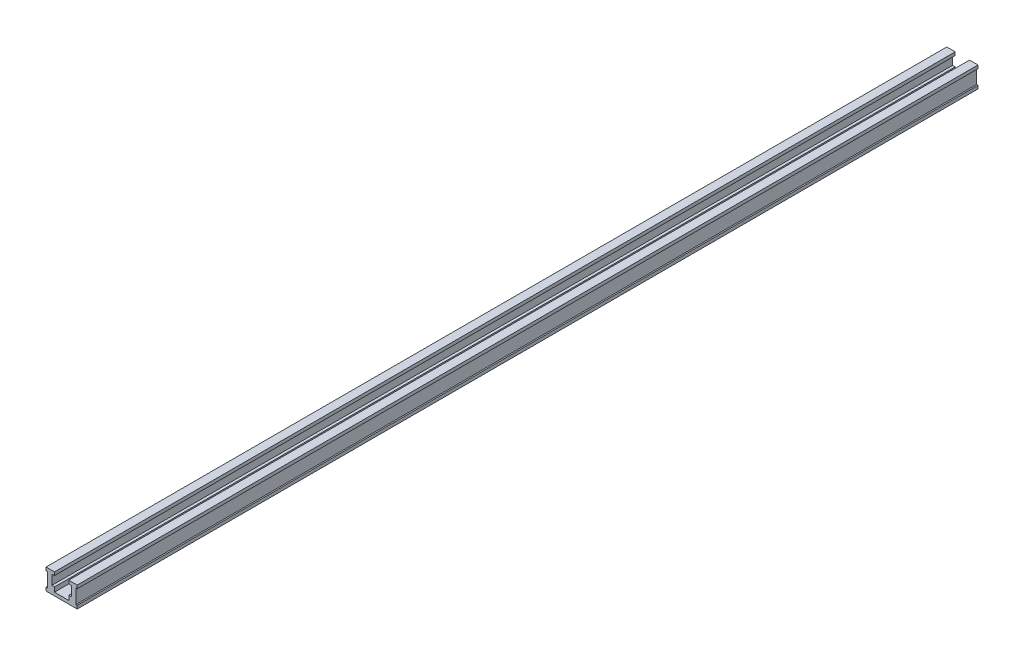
SolidWorks part; units mm, degrees
ref_plane "Piano frontale" through (0, 0, 0) normal (0, 0, 1) x (1, 0, 0)
ref_plane "Piano superiore" through (0, 0, 0) normal (0, 1, 0) x (1, 0, 0)
ref_plane "Piano destro" through (0, 0, 0) normal (1, 0, 0) x (0, 0, -1)
sketch "Schizzo1" plane through (0, 0, 0) normal (0, 0, 1) x (1, 0, 0)
  line L0 (3.7032, -9.4511) -> (3.7032, -11.4355)
  line L1 (-1.4561, -6.673) -> (0.1314, -6.673)
  line L2 (-1.4561, -9.4511) -> (-1.4561, -6.673)
  line L3 (2.9095, -0.7198) -> (2.9095, -9.4511)
  line L4 (2.9095, -9.4511) -> (3.7032, -9.4511)
  line L5 (3.7032, -0.7198) -> (2.9095, -0.7198)
  line L6 (3.7032, 1.2645) -> (3.7032, -0.7198)
  line L7 (-1.4561, 1.2645) -> (3.7032, 1.2645)
  line L8 (-1.4561, -0.7198) -> (-1.4561, 1.2645)
  line L9 (0.1314, -0.7198) -> (-1.4561, -0.7198)
  line L10 (0.1314, -6.673) -> (0.1314, -0.7198)
  line L11 (-10.1874, -6.673) -> (-10.1874, -9.4511)
  line L12 (-11.7749, -0.7198) -> (-11.7749, -6.673)
  line L13 (-11.7749, -6.673) -> (-10.1874, -6.673)
  line L14 (-10.1874, -0.7198) -> (-11.7749, -0.7198)
  line L15 (-14.553, -0.7198) -> (-15.3468, -0.7198)
  line L16 (-15.3468, 1.2645) -> (-10.1874, 1.2645)
  line L17 (-14.553, -9.4511) -> (-14.553, -0.7198)
  line L18 (-15.3468, -0.7198) -> (-15.3468, 1.2645)
  line L19 (-10.1874, 1.2645) -> (-10.1874, -0.7198)
  line L20 (-15.3468, -9.4511) -> (-14.553, -9.4511)
  line L21 (-15.3468, -11.4355) -> (-15.3468, -9.4511)
  line L22 (3.7032, -11.4355) -> (-15.3468, -11.4355)
  line L23 (-1.4561, -9.4511) -> (-10.1874, -9.4511)
extrude "Estrusione-Estrusione1" add sketch "Schizzo1" along normal blind 550
